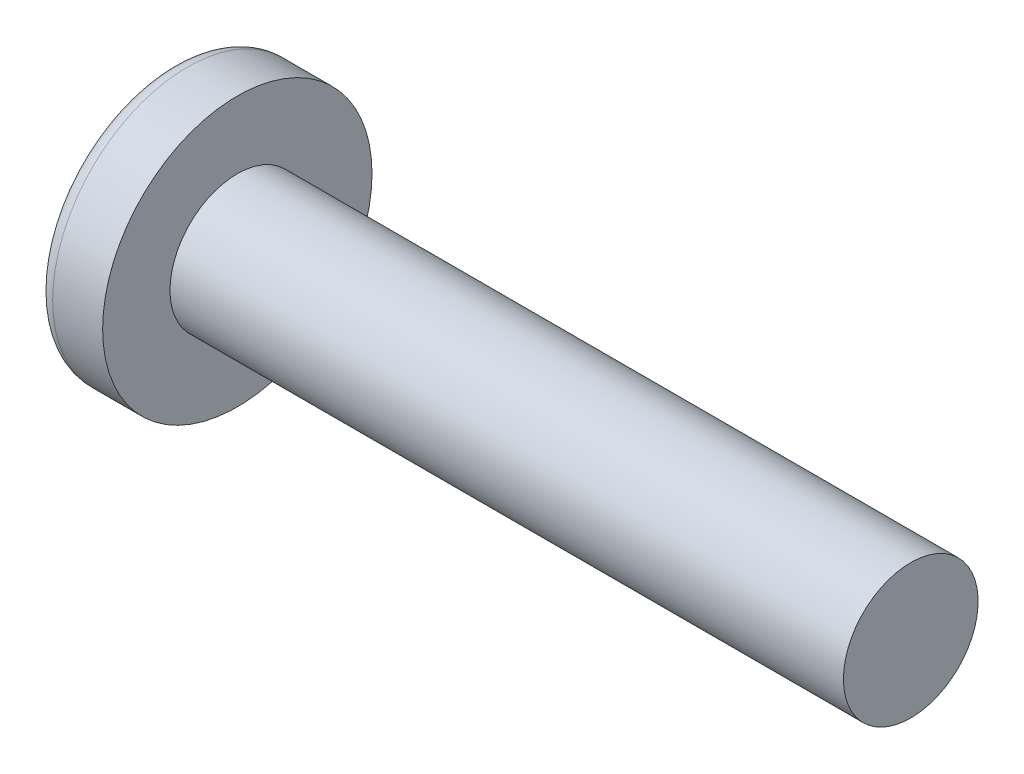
SolidWorks part; units mm, degrees
ref_plane "Plane1" through (0, 0, 0) normal (0, 0, 1) x (1, 0, 0)
ref_plane "Plane2" through (0, 0, 0) normal (0, 1, 0) x (1, 0, 0)
ref_plane "Plane3" through (0, 0, 0) normal (1, 0, 0) x (0, 0, -1)
sketch "BodySke" plane through (0, 0, 0) normal (0, 0, 1) x (1, 0, 0)
  line L0 (3.1, 2) -> (3.1, 4)
  line L1 (3.8, 6.35) -> (3.8, -3.175) construction
  line L2 (-25.4, 0) -> (127, 0) construction
  line L3 (23.1, 0) -> (0, 0)
  line L4 (3.1, 2) -> (23.1, 2)
  line L5 (23.1, 2) -> (23.1, 0)
  line L6 (1.6164, 4) -> (3.1, 4)
  line L7 (3.1, -2) -> (23.1, -2) construction
  line L8 (3.1, 6.35) -> (3.1, -3.175) construction
  arc A0 (1.227, 3.8007) -> (0, 0) centre (6.5, 0) ccw
  arc A2 (1.227, 3.8007) -> (1.6164, 4) centre (1.6164, 3.52) cw
revolve "Base-Revolve" add sketch "BodySke" angle 360 about L2
sketch "Sketch3" plane through (0, 0, 0) normal (1, 0, 0) x (0, 0, -1)
  line L0 (0.465, -2.2) -> (-0.465, -2.2)
  line L1 (0.465, -2.2) -> (0.465, 2.2)
  line L2 (-0.465, 2.2) -> (0.465, 2.2)
  line L3 (-0.465, 2.2) -> (-0.465, -2.2)
ref_plane "Plane4" through (2.45, 0, 0) normal (1, 0, 0) x (0, 0, -1)
sketch "Sketch4" plane through (2.45, 0, 0) normal (1, 0, 0) x (0, 0, -1)
  line L0 (0.2325, -0.2325) -> (-0.2325, -0.2325)
  line L1 (0.2325, -0.2325) -> (0.2325, 0.2325)
  line L2 (-0.2325, 0.2325) -> (0.2325, 0.2325)
  line L3 (-0.2325, 0.2325) -> (-0.2325, -0.2325)
loft "Cut-Loft1" cut profiles "Sketch3", "Sketch4"
pattern_circular "CirPattern1" count 2 every 90 about axis through (0, 0, 0) along (1, 0, 0) of "Cut-Loft1"
sketch "ThdSchSke" plane through (0, 0, 0) normal (0, 0, 1) x (1, 0, 0)
  line L0 (3.8, -1.61) -> (3.5269, -2)
  line L1 (3.8, -1.61) -> (4.0731, -2)
  line L2 (4.0731, -2) -> (4.0731, -2.5)
  line L3 (-3.175, 0) -> (5.1513, 0) construction
  line L5 (4.0731, -2.5) -> (3.5269, -2.5)
  line L6 (3.5269, -2.5) -> (3.5269, -2)
revolve "ThreadSchematic" [suppressed] cut sketch "ThdSchSke" angle 360 about L3
pattern_linear "ThdSchPat" [suppressed]
equation "\"D1@Sketch3\" = \"Cross_dia@Sketch3\" / 2"
equation "\"D2@Sketch3\" = \"Cross_width@Sketch3\" / 2"
equation "\"D1@Sketch4\" = \"Cross_width@Sketch3\" *.5"
equation "\"D2@Sketch4\" = \"D1@Sketch4\""
equation "\"D3@Sketch4\" = \"D1@Sketch4\" / 2"
equation "\"D4@Sketch4\" = \"D2@Sketch4\" / 2"
equation "\"Thread_length@ThreadCosmetic\" = ((sgn( (\"Length@BodySke\" - \"Advance@BodySke\" ) - \"Thread_nom@BodySke\" )-1)*( (\"Length@BodySke\" - \"Advance@BodySke\" ) - \"Thread_nom@BodySke\" ))/-2+ \"Thread_nom@BodySke\""
equation "\"Thread_minor@ThdSchSke\" = \"Thread_minor@ThreadCosmetic\""
equation "\"Diameter@ThdSchSke\" = \"Diameter@BodySke\""
equation "\"Overcut@ThdSchSke\" = \"Diameter@BodySke\" * 1.25"
equation "\"Start@ThdSchSke\" = \"Head_ht@BodySke\" + \"Length@BodySke\" - \"Thread_length@ThreadCosmetic\"  '---Non-countersunk---"
equation "\"Num_threads@ThdSchPat\" = int( \"Thread_length@ThreadCosmetic\" / \"Advance@BodySke\" + 0.999 )  + 1"
equation "\"Advance@ThdSchPat\" = \"Thread_length@ThreadCosmetic\" /  (\"Num_threads@ThdSchPat\" - 1) 'relax it"
